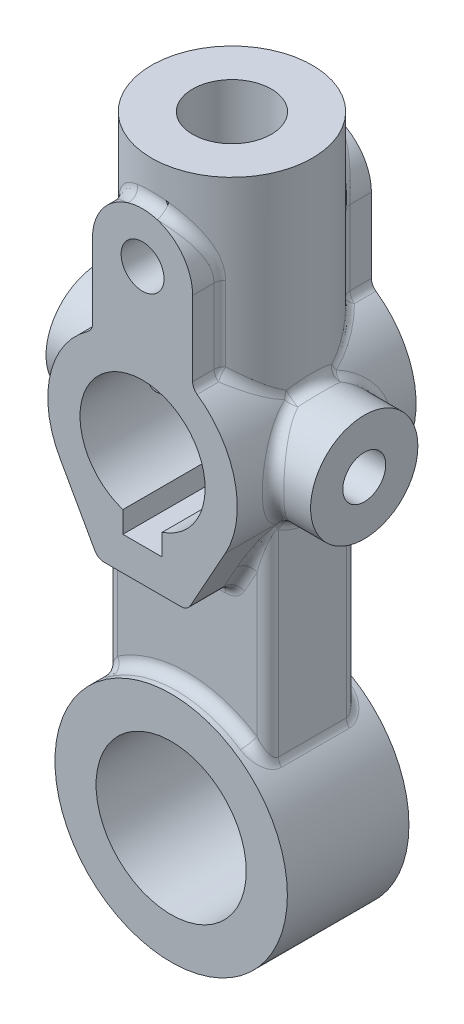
SolidWorks part; units mm, degrees
ref_plane "Front" through (0, 0, 0) normal (0, 0, 1) x (1, 0, 0)
ref_plane "Top" through (0, 0, 0) normal (0, 1, 0) x (1, 0, 0)
ref_plane "Right" through (0, 0, 0) normal (1, 0, 0) x (0, 0, -1)
sketch "Sketch1" plane through (0, 0, 0) normal (0, 0, 1) x (1, 0, 0)
  line L0 (0, 0) -> (0, 45) construction
  line L1 (14, 22.5) -> (14, 45)
  line L2 (-14, 22.5) -> (-14, 45)
  line L3 (-12.5, -32) -> (12.5, -32)
  line L4 (12.5, -32) -> (23.1461, -12.9039)
  line L5 (-12.5, -32) -> (-23.1461, -12.9039)
  line L6 (0, 0) -> (0, -32) construction
  arc A0 (23.1461, -12.9039) -> (14, 22.5) centre (0, 0) ccw
  arc A1 (-14, 45) -> (14, 45) centre (0, 45) cw
  arc A2 (-14, 22.5) -> (-23.1461, -12.9039) centre (0, 0) ccw
  dimension "D1" = 14
  dimension "D2" = 45
  dimension "D3" = 53
  dimension "D4" = 32
  dimension "D5" = 25
extrude "Base-Extrude" add sketch "Sketch1" along normal mid plane 50
sketch "Sketch2" plane through (0, 0, 0) normal (0, 1, 0) x (1, 0, 0)
  circle A0 centre (0, 0) radius 22.5
  dimension "D1" = 45
extrude "Boss-Extrude1" add sketch "Sketch2" along normal blind 70
sketch "Sketch3" plane through (0, 0, 0) normal (0, 1, 0) x (1, 0, 0)
  line L0 (0, 0) -> (22.5, 0) construction
  line L1 (-22.5, 12.5) -> (22.5, 12.5)
  line L2 (-22.5, 12.5) -> (-22.5, -12.5)
  line L3 (-22.5, -12.5) -> (22.5, -12.5)
  line L4 (22.5, 12.5) -> (22.5, -12.5)
  circle A0 centre (0, 0) radius 22.5 construction
  dimension "D1" = 25
extrude "Boss-Extrude2" add sketch "Sketch3" against normal blind 95
sketch "Sketch4" plane through (0, 0, 0) normal (0, 0, 1) x (1, 0, 0)
  line L0 (0, 70) -> (0, 22.5) construction
  line L1 (-22.5, -95) -> (22.5, -95) construction
  circle A0 centre (0, -95) radius 32.5
  dimension "D1" = 65
extrude "Boss-Extrude3" add sketch "Sketch4" along normal mid plane 34
sketch "Sketch5" plane through (0, 0, 0) normal (1, 0, 0) x (0, 0, -1)
  circle A0 centre (0, 0) radius 15
  dimension "D1" = 30
extrude "Boss-Extrude4" add sketch "Sketch5" along normal mid plane 74
sketch "Sketch7" plane through (0, 0, 0) normal (0, 0, 1) x (1, 0, 0)
  line L0 (0, 0) -> (0, -22.6132) construction
  line L1 (0, 70) -> (0, 14.5086) construction
  line L2 (-5.5, -22.6132) -> (5.5, -22.6132)
  line L3 (5.5, -22.6132) -> (5.5, -16.6132)
  line L4 (-5.5, -22.6132) -> (-5.5, -16.6132)
  arc A0 (5.5, -16.6132) -> (-5.5, -16.6132) centre (0, 0) ccw
  dimension "D1" = 35
  dimension "D2" = 11
  dimension "D3" = 6
extrude "Cut-Extrude2" cut sketch "Sketch7" against normal through all and the other way through all
sketch "Sketch10" plane through (0, 0, 0) normal (0, 0, 1) x (1, 0, 0)
  line L0 (0, 70) -> (0, 14.5086) construction
  circle A0 centre (0, 45) radius 6
  arc A1 (14, 45) -> (-14, 45) centre (0, 45) ccw construction
  dimension "D1" = 12
extrude "Cut-Extrude5" cut sketch "Sketch10" against normal through all and the other way through all
sketch "Sketch6" plane through (0, 0, 0) normal (1, 0, 0) x (0, 0, -1)
  circle A0 centre (0, 0) radius 6
  dimension "D1" = 12
extrude "Cut-Extrude1" cut sketch "Sketch6" against normal through all and the other way through all
sketch "Sketch8" plane through (0, 70, 0) normal (0, 1, 0) x (-1, 0, 0)
  circle A0 centre (0, 0) radius 11
  dimension "D1" = 22
extrude "Cut-Extrude3" cut sketch "Sketch8" against normal up to next
sketch "Sketch9" plane through (0, 0, 0) normal (0, 0, 1) x (1, 0, 0)
  circle A0 centre (0, -95) radius 21
  dimension "D1" = 42
extrude "Cut-Extrude4" cut sketch "Sketch9" against normal through all and the other way through all
fillet "Rounds" radius 3 8 edges at (12.5, -32, 18.75) (-12.5, -32, 18.75) (12.5, -32, -18.75) (-12.5, -32, -18.75) (-22.5, -42.8053, 12.5) (22.5, -42.8053, 12.5) (22.5, -42.8053, -12.5) (-22.5, -42.8053, -12.5)
fillet "Fillets.1" radius 3 4 edges at (-14, 22.5, 21.307) (14, 22.5, 21.307) (14, 22.5, -21.307) (-14, 22.5, -21.307)
fillet "Fillets.2" radius 3 46 edges at (0, -62.5, 12.5) (16.429, -24.9524, 12.5) (0, -32, 12.5) (-16.429, -24.9524, 12.5) (22.5, -14.0627, 7.3596) (22.5, -71.5479, 0) (0, -62.5, -12.5) (-16.429, -24.9524, -12.5) (0, -32, -12.5) (16.429, -24.9524, -12.5) (-22.5, -14.0627, -7.3596) (-22.5, -71.5479, 0) (21.6213, -15.6388, 11.6213) (22.0944, -71.1654, 11.0064) (21.6213, -15.6388, -11.6213) (21.741, -70.8426, -11.4945) (-21.6213, -15.6388, 11.6213) (-21.741, -70.8426, 11.4945) (-21.6213, -15.6388, -11.6213) (-22.0944, -71.1654, -11.0064) (-12.2572, -31.5867, -12.5) (12.2572, -31.5867, -12.5) (-12.2572, -31.5867, 12.5) (12.2572, -31.5867, 12.5) (14, 34.5546, -17.6139) (-21.3263, 15.7301, -7.172) (-14, 34.5546, 17.6139) (20.174, 17.1831, 9.9628) (-14.1853, 23.071, 17.465) (-14.4347, 22.5538, -17.2595) (14.1853, 23.071, -17.465) (14.4347, 22.5538, 17.2595) (14, 34.5546, 17.6139) (0.425, 31.0065, -22.496) (-14, 34.5546, -17.6139) (0.425, 58.9935, 22.496) (20.6258, 16.638, -8.9902) (-21.7119, 15.1935, 5.9027) (-22.4982, 14.9973, -0.2837) (22.5, -14.0627, -7.3596) (-22.5, -14.0627, 7.3596) (22.7926, -13.5379, -6.4596) (26.0345, -4.945, -14.1615) (-22.7926, -13.5379, 6.4596) (-26.0345, 4.945, -14.1615)
fillet "Fillets.3" radius 3 40 edges at (-22.5, -15, 0) (-22.5, -14.8425, 5.8341) (-22.5, -14.8425, -5.8341) (23.0089, -13.15, -7.2165) (21.1223, -16.5339, -13.7426) (22.8797, -13.3817, -8.1386) (22.5, -15, 0) (22.5, -14.8425, 5.8341) (22.5, -14.8425, -5.8341) (26.0345, -4.945, -14.1615) (22.3282, 14.6395, -3.2689) (22.5261, -14.4479, 4.0321) (22.7065, -13.7487, -5.9978) (-22.8797, -13.3817, -8.1386) (-23.0089, -13.15, 7.2165) (-26.0345, 4.945, -14.1615) (-22.336, 14.6734, 3.113) (-22.7065, -13.7487, 5.9978) (-22.5261, -14.4479, -4.0321) (-21.1223, -16.5339, 13.7426) (-22.8797, -13.3817, 8.1386) (22.8797, -13.3817, 8.1386) (-21.6561, 16.3665, 6.1043) (21.6561, 16.3665, -6.1043) (-19.5323, 17.9092, -13.3218) (-21.6213, -17.9947, -11.6213) (21.6213, -17.9947, 11.6213) (19.5323, 17.9092, 13.3218) (-22.5965, -14.0878, -9.5) (22.5965, -14.0878, -9.5) (22.5965, -14.0878, 9.5) (-22.5965, -14.0878, 9.5) (26.4999, 0.0659, -14.9999) (23.0089, -13.15, 7.2165) (-26.4999, -0.0659, -14.9999) (-23.0089, -13.15, -7.2165)
equation "\"AllFillets\"= 3"
equation "\"D1@Fillets.1\"=\"AllFillets\""
equation "\"D1@Fillets.2\"=\"AllFillets\""
equation "\"D1@Fillets.3\"=\"AllFillets\""
